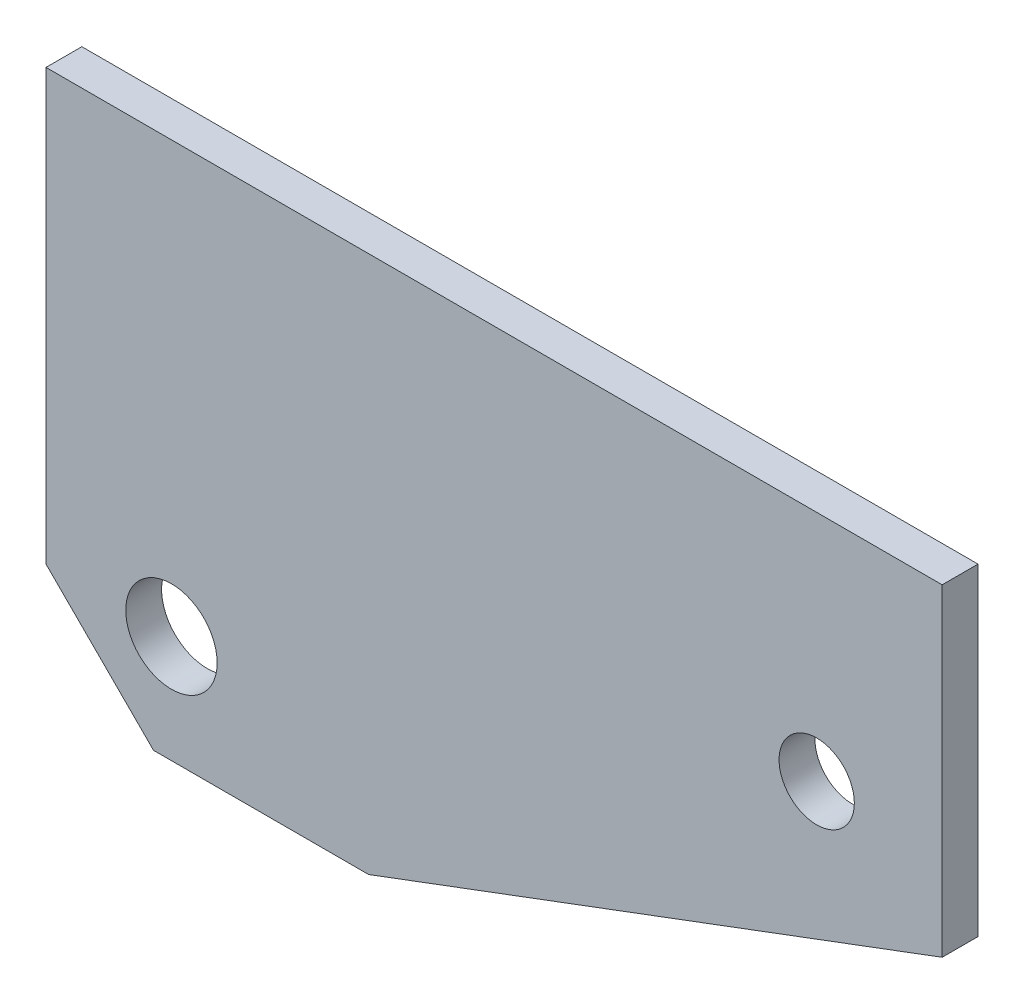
SolidWorks part; units mm, degrees
ref_plane "Face" through (0, 0, 0) normal (0, 0, 1) x (1, 0, 0)
ref_plane "Dessus" through (0, 0, 0) normal (0, 1, 0) x (1, 0, 0)
ref_plane "Droite" through (0, 0, 0) normal (1, 0, 0) x (0, 0, -1)
sketch "Esquisse1" plane through (0, 0, 0) normal (0, 0, 1) x (1, 0, 0)
  line L0 (0, -120) -> (30, -150)
  line L1 (0, 0) -> (250, 0)
  line L2 (0, 0) -> (0, -120)
  line L3 (30, -150) -> (90, -150)
  line L4 (250, 0) -> (250, -90)
  line L5 (90, -150) -> (250, -90)
  circle A0 centre (215, -65) radius 10.5
  circle A1 centre (35, -120) radius 12.75
  point P2 (0, -150)
  dimension "D10" = 21
  dimension "D11" = 25.5
  dimension "D1" = 250
  dimension "D2" = 150
  dimension "D6" = 30
  dimension "D3" = 120
  dimension "D4" = 35
  dimension "D5" = 90
  dimension "D7" = 90
  dimension "D8" = 65
  dimension "D9" = 215
extrude "Base-Extrusion" add sketch "Esquisse1" along normal blind 10
